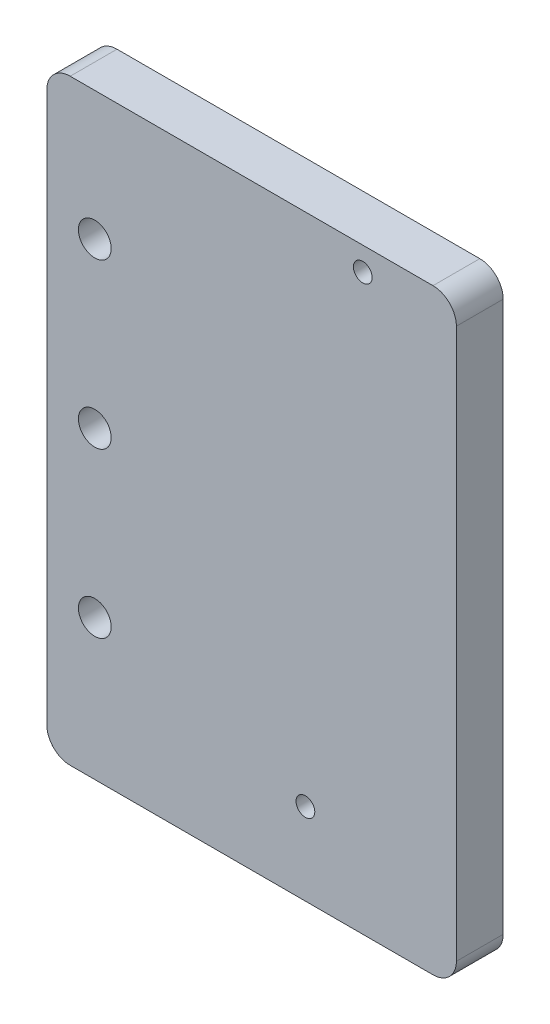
SolidWorks part; units mm, degrees
ref_plane "Plan de face" through (0, 0, 0) normal (0, 0, 1) x (1, 0, 0)
ref_plane "Plan de dessus" through (0, 0, 0) normal (0, 1, 0) x (1, 0, 0)
ref_plane "Plan de droite" through (0, 0, 0) normal (1, 0, 0) x (0, 0, -1)
sketch "Esquisse1" plane through (0, 0, 0) normal (0, 0, 1) x (1, 0, 0)
  line L1 (10, 0) -> (165, 0)
  line L2 (0, 10) -> (0, 245)
  line L3 (10, 255) -> (165, 255)
  line L4 (175, 10) -> (175, 245)
  arc A0 (10, 255) -> (0, 245) centre (10, 245) ccw
  arc A1 (175, 245) -> (165, 255) centre (165, 245) ccw
  arc A2 (165, 0) -> (175, 10) centre (165, 10) ccw
  arc A3 (0, 10) -> (10, 0) centre (10, 10) ccw
  point P7 (0, 255)
  point P12 (175, 0)
  point P15 (0, 0)
  dimension "D3" = 10
  dimension "D1" = 255
  dimension "D2" = 175
extrude "Extrusion1" add sketch "Esquisse1" along normal blind 20
hole_wizard "Trou taraudé M16x2.01" positions "Esquisse3D1" profile "Esquisse3" tap size "M16x2.0" standard "Ansi Métrique"
sketch3d "Esquisse3D1"
  line L0 (20.5, 60, 0) -> (20.5, 229.9097, 0) construction
  line L2 (10, 0, 0) -> (165, 0, 0) construction
  line L3 (0, 245, 0) -> (0, 10, 0) construction
  point P0 (20.5, 60, 0)
  point P21 (20.5, 130, 0)
  point P23 (20.5, 200, 0)
  dimension "D1" = 60
  dimension "D2" = 20.5
  dimension "D3" = 70
  dimension "D4" = 70
sketch "Esquisse3" plane through (20.5, 60, 0) normal (1, 0, 0) x (0, 1, 0)
  line L0 (0, 0) -> (0, 34.206)
  line L1 (0, 34.206) -> (7, 30)
  line L2 (7, 30) -> (7, 0)
  line L5 (7, 0) -> (0, 0)
  line L10 (0, 34.206) -> (-7, 30) construction
  line L11 (0, -6.35) -> (0, 107.95) construction
  dimension "Diamètre du trou pour taraudage" = 14
  dimension "Profondeur du trou pour taraudage" = 30
  dimension "Angle de pointe" = 118
hole_wizard "Trou taraudé M10x1.51" positions "Esquisse5" profile "Esquisse4" tap size "M10x1.5" standard "Ansi Métrique"
sketch "Esquisse5" plane through (0, 0, 0) normal (0, 0, -1) x (-1, 0, 0)
  line L0 (-175, 10) -> (-175, 245) construction
  line L1 (-165, 255) -> (-10, 255) construction
  circle A0 centre (-20.5, 60) radius 7 construction
  point P0 (-110.5, 35)
  point P1 (-135, 245)
  dimension "D1" = 90
  dimension "D2" = 25
  dimension "D3" = 40
  dimension "D4" = 10
sketch "Esquisse4" plane through (110.5, 35, 0) normal (1, 0, 0) x (0, 1, 0)
  line L0 (0, 0) -> (0, 35.4034)
  line L1 (0, 35.4034) -> (4, 33)
  line L2 (4, 33) -> (4, 0)
  line L5 (4, 0) -> (0, 0)
  line L10 (0, 35.4034) -> (-4, 33) construction
  line L11 (0, -6.35) -> (0, 107.95) construction
  dimension "Diamètre du trou pour taraudage" = 8
  dimension "Profondeur du trou pour taraudage" = 33
  dimension "Angle de pointe" = 118
